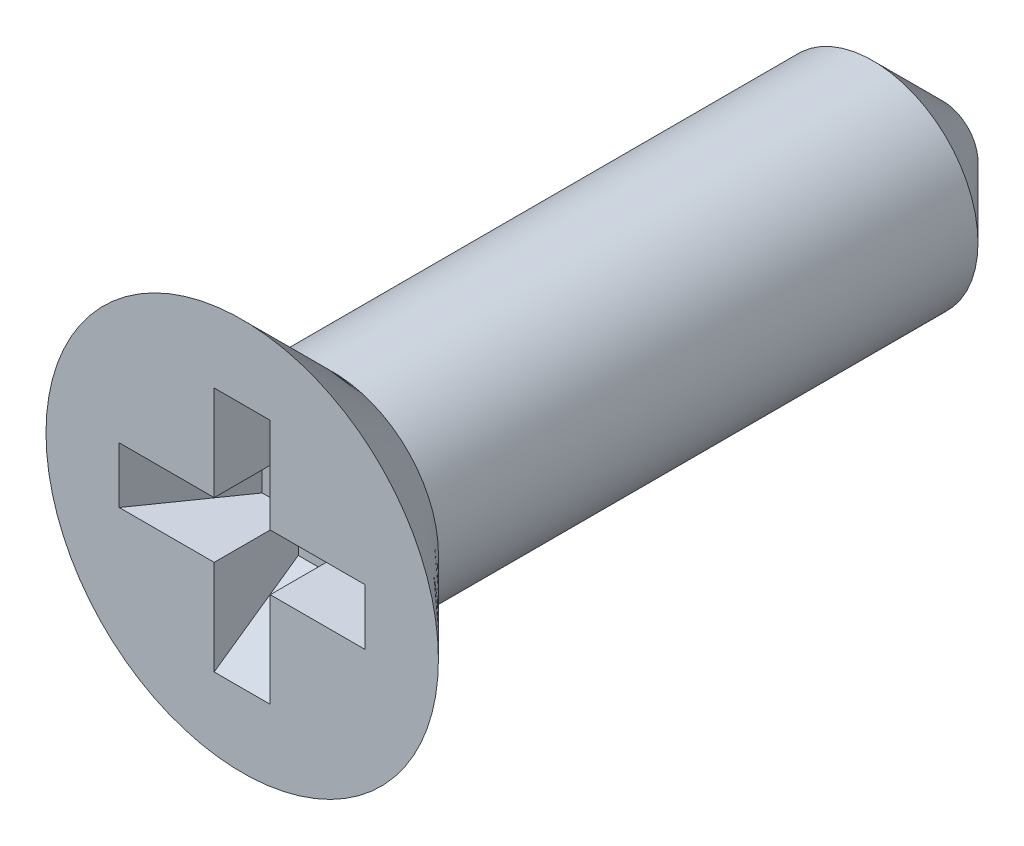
SolidWorks part; units mm, degrees
ref_plane "Plan de face" through (0, 0, 0) normal (0, 0, 1) x (1, 0, 0)
ref_plane "Plan de dessus" through (0, 0, 0) normal (0, 1, 0) x (1, 0, 0)
ref_plane "Plan de droite" through (0, 0, 0) normal (1, 0, 0) x (0, 0, -1)
sketch "Esquisse1" plane through (0, 0, 0) normal (1, 0, 0) x (0, 0, -1)
  line L0 (-1.6035, 0) -> (7.1529, 0) construction
  line L1 (0, 5.0438) -> (0, -4.594) construction
  line L2 (0, 2.8) -> (1.3, 1.5)
  line L3 (1.3, 1.5) -> (1.3, 0)
  line L4 (-1.442, 2.8) -> (2.7621, 2.8) construction
  line L5 (0, 2.8) -> (8.0274, -5.2274) construction
  line L6 (-1.0988, 1.5) -> (4.1029, 1.5) construction
  line L7 (1.3, 0) -> (0, 0)
  line L9 (0, 2.8) -> (0, 0)
revolve "Révolution2" add sketch "Esquisse1" angle 360 about L0
sketch "Esquisse3" plane through (0, 0, 0) normal (0, 0, 1) x (1, 0, 0)
  circle A0 centre (0, 0) radius 1.5
extrude "Extrusion1" add sketch "Esquisse3" against normal blind 10
sketch "Esquisse2" plane through (0, 0, 0) normal (0, 0, 1) x (1, 0, 0)
  line L0 (0.4, -0.4) -> (1.755, -0.4)
  line L1 (0.4, 0.4) -> (1.755, 0.4)
  line L2 (-1.755, -0.4) -> (-0.4, -0.4)
  line L3 (-0.4, 1.755) -> (-0.4, 0.4)
  line L4 (-1.755, 0.4) -> (-0.4, 0.4)
  line L5 (0.4, 1.755) -> (0.4, 0.4)
  line L6 (-0.4, 1.755) -> (0.4, 1.755)
  line L7 (1.755, 0.4) -> (1.755, -0.4)
  line L8 (0.4, -1.755) -> (-0.4, -1.755)
  line L9 (-1.755, -0.4) -> (-1.755, 0.4)
  line L10 (-0.4, -0.4) -> (-0.4, -1.755)
  line L12 (0.4, -0.4) -> (0.4, -1.755)
  circle A0 centre (0, 0) radius 1.8 construction
extrude "Enlèv. mat.-Extru.2" cut sketch "Esquisse2" against normal blind 1.2
draft "Dépouille3" type of draft neutral plane draft angle 35 faces to draft 4 parameters "D1"=35
chamfer "Chanfrein1" distance 1 angle 45 1 edges at (1.5, 0, -10)
